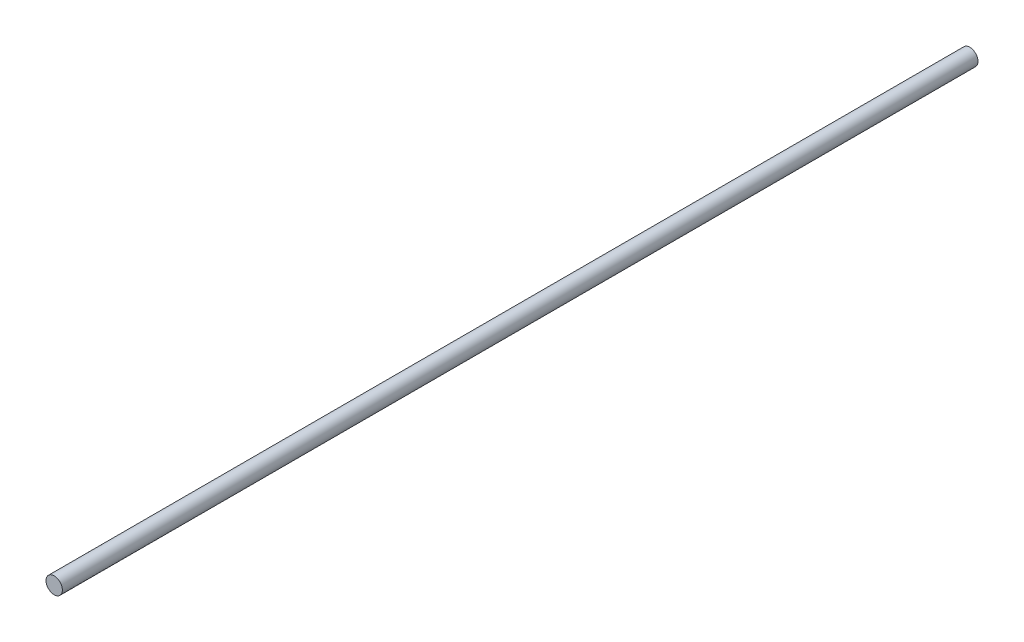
SolidWorks part; units mm, degrees
ref_plane "Front Plane" through (0, 0, 0) normal (0, 0, 1) x (1, 0, 0)
ref_plane "Top Plane" through (0, 0, 0) normal (0, 1, 0) x (1, 0, 0)
ref_plane "Right Plane" through (0, 0, 0) normal (1, 0, 0) x (0, 0, -1)
sketch "Sketch1" plane through (0, 0, 0) normal (0, 0, 1) x (1, 0, 0)
  circle A0 centre (0, 0) radius 30
  dimension "D1" = 60
extrude "Boss-Extrude1" add sketch "Sketch1" against normal blind 3350
